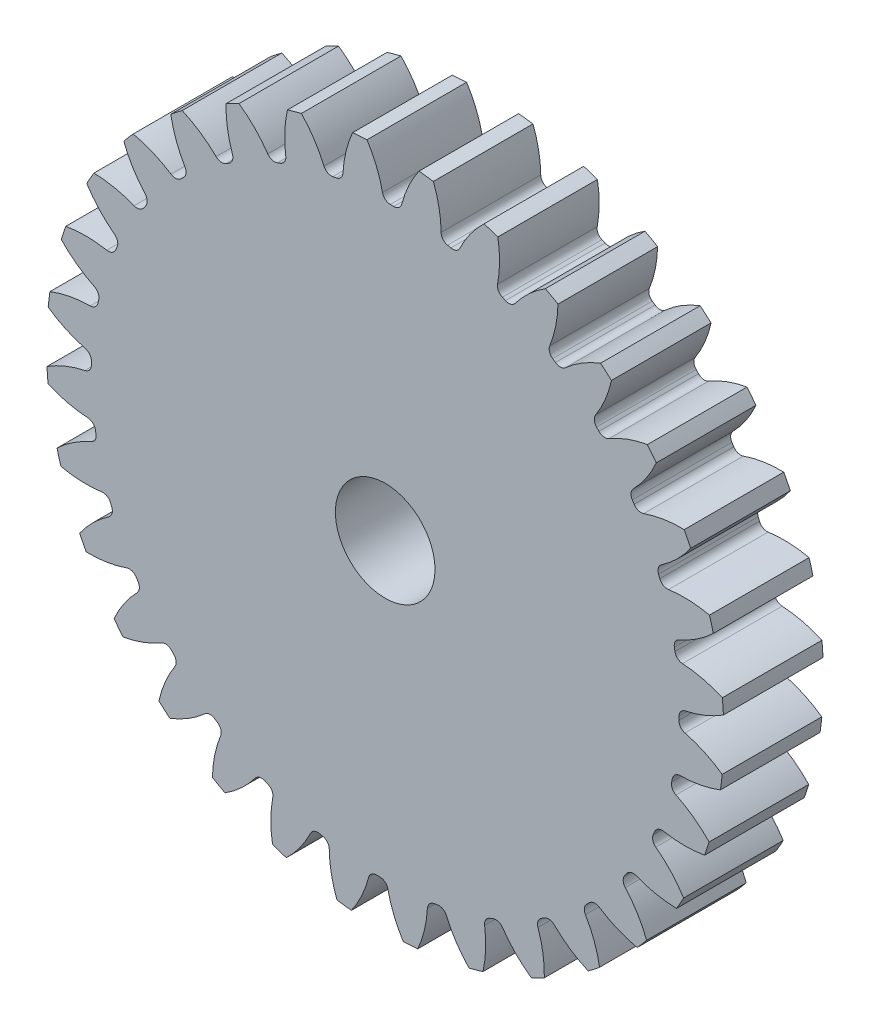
SolidWorks part; units mm, degrees
ref_plane "Front" through (0, 0, 0) normal (0, 0, 1) x (1, 0, 0)
ref_plane "Top" through (0, 0, 0) normal (0, 1, 0) x (1, 0, 0)
ref_plane "Right" through (0, 0, 0) normal (1, 0, 0) x (0, 0, -1)
sketch "Sketch3" plane through (0, 0, 0) normal (0, 0, 1) x (1, 0, 0)
  circle A0 centre (0, 0) radius 345.44
  dimension "od" = 690.88
extrude "gearBody" add sketch "Sketch3" along normal blind 101.6
sketch "Sketch2" plane through (0, 0, 0) normal (0, 0, 1) x (1, 0, 0)
  line L0 (0, 0) -> (282.2571, 116.9147) construction
  line L1 (344.1986, -34.8113) -> (0, 0) construction
  line L2 (0, 0) -> (36.3143, 0) construction
  line L3 (325.0119, 8.3852) -> (324.2767, -23.4023) construction
  line L5 (324.6443, -7.5085) -> (0, 0) construction
  line L7 (0, 0) -> (305.5129, 0) construction
  arc A0 (305.5017, 2.6067) -> (305.0546, -16.728) centre (0, 0) ccw construction
  arc A1 (344.942, 18.5418) -> (343.7159, -34.4695) centre (0, 0) ccw construction
  arc A2 (325.0119, 8.3852) -> (324.2767, -23.4023) centre (0, 0) ccw construction
  arc A3 (299.5946, -8.67) -> (299.6751, -5.1902) centre (0, 0) ccw
  arc A4 (344.1986, -34.8113) -> (305.7884, -16.9155) centre (276.55, -129.8391) ccw
  arc A5 (344.1986, -34.8113) -> (345.44, 18.8609) centre (0, 0) ccw
  arc A6 (345.44, 18.8609) -> (306.2434, 2.7601) centre (282.2571, 116.9147) cw
  arc A7 (299.6751, -5.1902) -> (306.2434, 2.7601) centre (307.9441, -5.3334) cw
  arc A8 (305.7884, -16.9155) -> (299.5946, -8.67) centre (307.8614, -8.9092) cw
  point P6 (345.44, 18.8609)
  point P22 (344.1986, -34.8113)
  dimension "baseDia" = 611.0257
  dimension "od" = 690.88
  dimension "pd" = 650.24
  dimension "rd" = 599.44
  dimension "rFillet" = 8.2702
  dimension "pointX" = 345.44
  dimension "pointY" = 18.8609
  dimension "CTT" = 31.7875
  dimension "flankCenterAngle" = 22.5
extrude "toothCut" cut sketch "Sketch2" along normal through all
pattern_circular "CirPattern1" count 32 over 360 about axis through (0, 0, 0) along (0, 0, 1) of "toothCut"
sketch "hub1Dia" plane through (0, 0, 0) normal (0, 0, -1) x (-1, 0, 0)
  circle A0 centre (0, 0) radius 12.7
  dimension "hub1Dia" = 25.4
sketch "hub2Dia" plane through (0, 0, 101.6) normal (0, 0, 1) x (1, 0, 0)
  circle A0 centre (0, 0) radius 12.7
  dimension "hub2dia" = 25.4
sketch "boreDia" plane through (0, 0, 0) normal (0, 0, 1) x (1, 0, 0)
  circle A0 centre (0, 0) radius 50.8
  dimension "boreDia" = 101.6
extrude "bore" cut sketch "boreDia" against normal mid plane 25400
